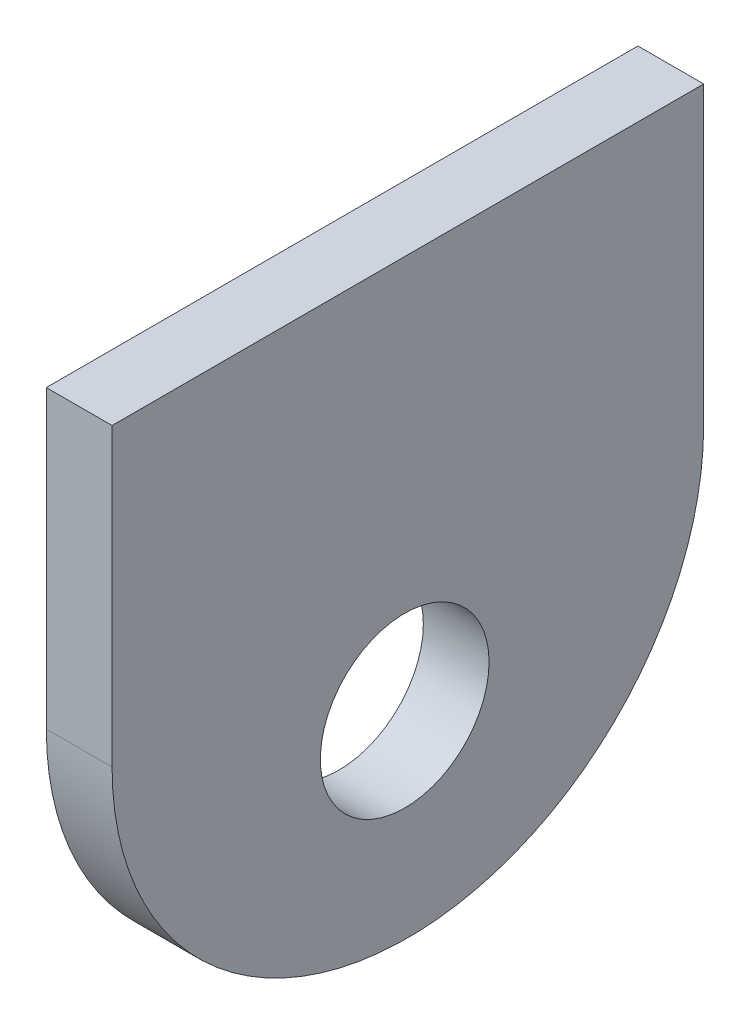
SolidWorks part; units mm, degrees
ref_plane "Front Plane" through (0, 0, 0) normal (0, 0, 1) x (1, 0, 0)
ref_plane "Top Plane" through (0, 0, 0) normal (0, 1, 0) x (1, 0, 0)
ref_plane "Right Plane" through (0, 0, 0) normal (1, 0, 0) x (0, 0, -1)
sketch "Sketch1" plane through (0, 0, 0) normal (1, 0, 0) x (0, 0, -1)
  line L0 (-13.5, 0) -> (-13.5, 13.5)
  line L1 (-13.5, 13.5) -> (13.5, 13.5)
  line L2 (13.5, 13.5) -> (13.5, 0)
  line L5 (0, -13.5) -> (-5.1054, -13.5) construction
  line L6 (-5.1054, -13.5) -> (4.0978, -13.5) construction
  line L7 (0, -13.5) -> (0, -8.2963) construction
  arc A1 (-13.5, 0) -> (13.5, 0) centre (0, 0) ccw
  circle A2 centre (-0.144, -4.449) radius 3.85
  dimension "D2" = 27
  dimension "D3" = 7.7
extrude "Boss-Extrude1" add sketch "Sketch1" along normal blind 3
